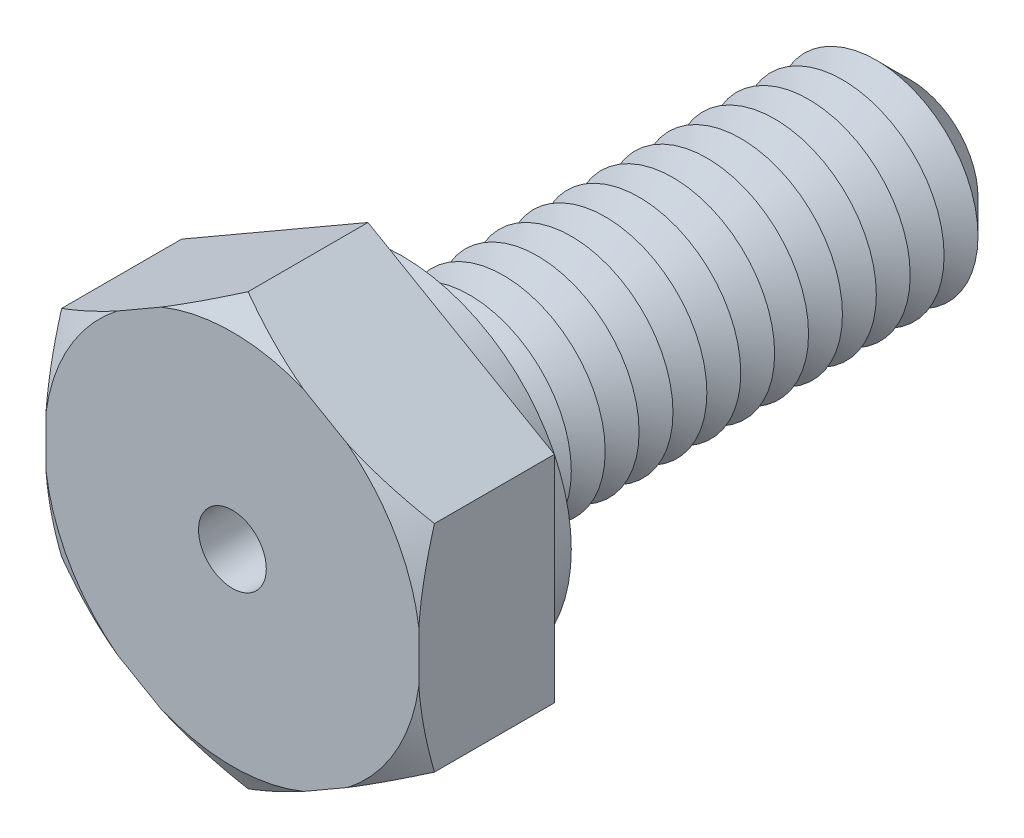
SolidWorks part; units mm, degrees
ref_plane "Front Plane" through (0, 0, 0) normal (0, 0, 1) x (1, 0, 0)
ref_plane "Top Plane" through (0, 0, 0) normal (0, 1, 0) x (1, 0, 0)
ref_plane "Right Plane" through (0, 0, 0) normal (1, 0, 0) x (0, 0, -1)
sketch "Sketch2" plane through (0, 0, 0) normal (0, 0, 1) x (1, 0, 0)
  line L1 (0, 3.1754) -> (-2.75, 1.5877)
  line L2 (-2.75, 1.5877) -> (-2.75, -1.5877)
  line L3 (-2.75, -1.5877) -> (0, -3.1754)
  line L4 (0, -3.1754) -> (2.75, -1.5877)
  line L5 (2.75, -1.5877) -> (2.75, 1.5877)
  line L6 (2.75, 1.5877) -> (0, 3.1754)
  circle A0 centre (0, 0) radius 2.75 construction
  dimension "D1" = 5.5
extrude "Boss-Extrude1" add sketch "Sketch2" along normal blind 2
sketch "Sketch3" plane through (0, 0, 0) normal (0, 0, -1) x (-1, 0, 0)
  circle A0 centre (0, 0) radius 1.5
  dimension "D1" = 3
extrude "Boss-Extrude2" add sketch "Sketch3" along normal blind 8
sketch "Sketch4" plane through (0, 0, 0) normal (0, 0, -1) x (-1, 0, 0)
  circle A0 centre (0, 0) radius 2.5
  dimension "D1" = 5
extrude "Boss-Extrude3" add sketch "Sketch4" along normal blind 0.5
sketch "Sketch5" plane through (0, 0, 0) normal (1, 0, 0) x (0, 0, -1)
  line L0 (-3.2117, 0) -> (6.3192, 0) construction
chamfer "Chamfer1" distance 0.5 angle 45 1 edges at (-1.5, 0, -8)
sketch "Sketch6" plane through (0, 0, 0) normal (1, 0, 0) x (0, 0, -1)
  line L0 (0.5, 1.5) -> (0.75, 1.067)
  line L1 (0.75, 1.067) -> (1, 1.5)
  line L2 (7.5, 1.5) -> (0.5, 1.5) construction
  line L3 (1, 1.5) -> (0.5, 1.5)
  dimension "D1" = 0.5
revolve "Cut-Revolve1" cut sketch "Sketch6" angle 360 about L0
pattern_linear "LPattern1" count 14 spacing 0.5 along (0, 0, -1) of "Cut-Revolve1"
sketch "Sketch7" plane through (0, 0, 0) normal (1, 0, 0) x (0, 0, -1)
  line L0 (-2, 3.1754) -> (-2, 2.7754)
  line L1 (-2, 1.5877) -> (-2, 3.1754) construction
  line L2 (-2, 2.7754) -> (-1.7691, 3.1754)
  line L3 (-2, 3.1754) -> (0, 3.1754) construction
  line L4 (-1.7691, 3.1754) -> (-2, 3.1754)
  dimension "D1" = 0.4
  dimension "D2" = 30
revolve "Cut-Revolve2" cut sketch "Sketch7" angle 360 about L0
sketch "Sketch8" plane through (0, 0, 2) normal (0, 0, 1) x (1, 0, 0)
  circle A0 centre (0, 0) radius 0.5
  dimension "D1" = 1
extrude "Cut-Extrude1" cut sketch "Sketch8" against normal up to surface (10 mm away)
